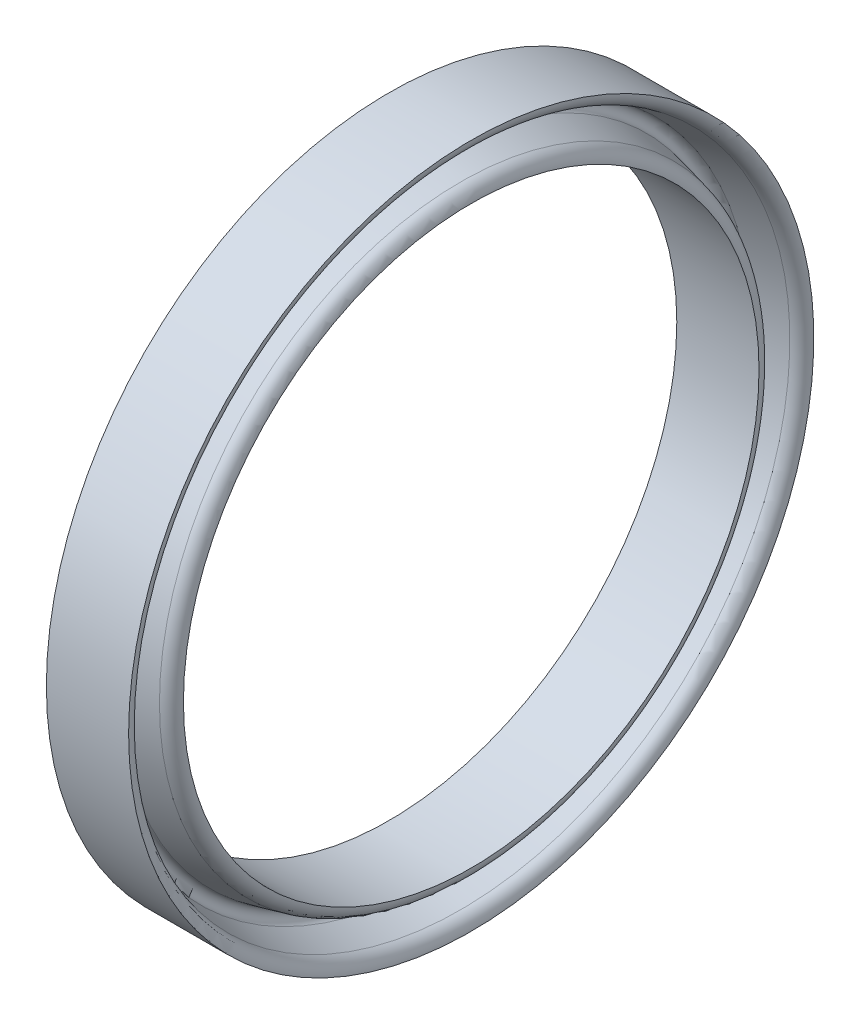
SolidWorks part; units mm, degrees
ref_plane "Plan1" through (0, 0, 0) normal (0, 0, 1) x (1, 0, 0)
ref_plane "Plan2" through (0, 0, 0) normal (0, 1, 0) x (1, 0, 0)
ref_plane "Plan3" through (0, 0, 0) normal (1, 0, 0) x (0, 0, -1)
sketch "Esquisse1" plane through (0, 0, 0) normal (0, 0, 1) x (1, 0, 0)
  line L0 (0, 0) -> (30, 0) construction
  line L1 (0, 21) -> (6, 21)
  line L2 (6, 25) -> (0, 25)
  line L3 (0, 25) -> (0, 21)
  line L5 (5.2245, 24.0255) -> (2.8878, 23.4872)
  line L6 (5.2245, 21.9745) -> (2.8878, 22.5128)
  line L7 (3, 23) -> (9.0825, 23) construction
  arc A0 (6, 25) -> (5.2245, 24.0255) centre (5, 25) cw
  arc A1 (2.8878, 23.4872) -> (2.8878, 22.5128) centre (3, 23) ccw
  arc A2 (5.2245, 21.9745) -> (6, 21) centre (5, 21) cw
  dimension "D3" = 1
  dimension "D4" = 0.5
  dimension "D1" = 42
  dimension "D2" = 50
  dimension "D5" = 2
  dimension "D6" = 6
revolve "BASE" add sketch "Esquisse1" angle 360 about L0
